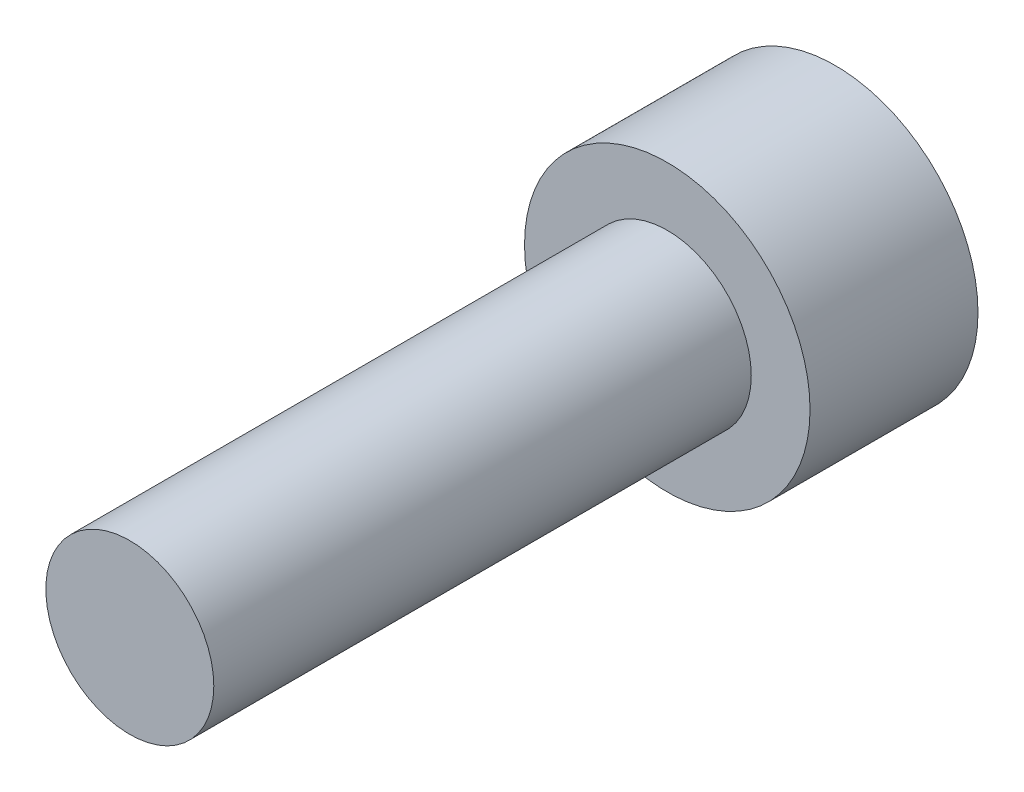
SolidWorks part; units mm, degrees
ref_plane "Front Plane" through (0, 0, 0) normal (0, 0, 1) x (1, 0, 0)
ref_plane "Top Plane" through (0, 0, 0) normal (0, 1, 0) x (1, 0, 0)
ref_plane "Right Plane" through (0, 0, 0) normal (1, 0, 0) x (0, 0, -1)
sketch "Sketch6" plane through (0, 0, 0) normal (1, 0, 0) x (0, 0, -1)
  line L0 (-16, 0) -> (22.525, 0) construction
  line L1 (4.675, 0) -> (-4.675, 0) construction
  line L2 (-16, 0) -> (-16, -2.5)
  line L3 (-16, -2.5) -> (0, -2.5)
  line L4 (0, 4.675) -> (0, -4.675) construction
  line L5 (0, -2.5) -> (0, -4.25)
  line L6 (0, -4.25) -> (5, -4.25)
  line L7 (5, -4.25) -> (5, 0)
  line L8 (5, 0) -> (-16, 0)
  dimension "L" = 16
  dimension "H" = 5
  dimension "A" = 8.5
  dimension "D" = 5
revolve "Revolve1" add sketch "Sketch6" angle 360 about L0
sketch "Sketch7" plane through (0, 0, -5) normal (0, 0, -1) x (-1, 0, 0)
  line L2 (-2, 1.1547) -> (-2, -1.1547)
  line L4 (-2, -1.1547) -> (0, -2.3094)
  line L5 (0, -2.3094) -> (2, -1.1547)
  line L6 (2, -1.1547) -> (2, 1.1547)
  line L7 (2, 1.1547) -> (0, 2.3094)
  line L8 (0, 2.3094) -> (-2, 1.1547)
  circle A0 centre (0, 0) radius 2 construction
  dimension "J" = 4
extrude "HEX" cut sketch "Sketch7" against normal blind 4
